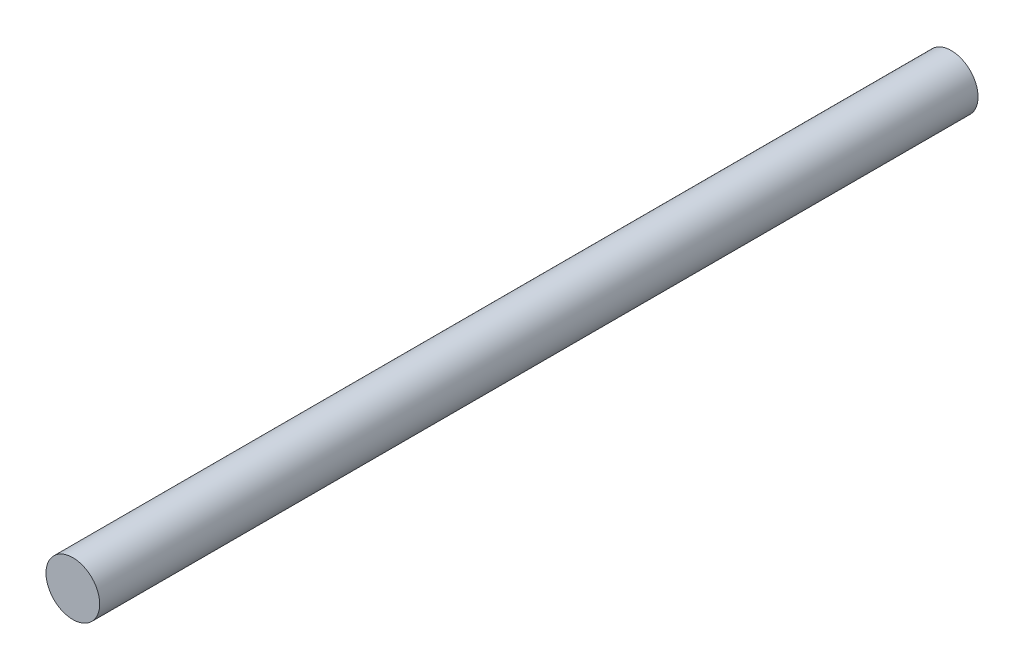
SolidWorks part; units mm, degrees
ref_plane "Front Plane" through (0, 0, 0) normal (0, 0, 1) x (1, 0, 0)
ref_plane "Top Plane" through (0, 0, 0) normal (0, 1, 0) x (1, 0, 0)
ref_plane "Right Plane" through (0, 0, 0) normal (1, 0, 0) x (0, 0, -1)
sketch "Sketch1" plane through (0, 0, 0) normal (0, 0, 1) x (1, 0, 0)
  circle A0 centre (0, 0) radius 2.75
  dimension "D1" = 5.5
extrude "Boss-Extrude1" add sketch "Sketch1" along normal blind 90
